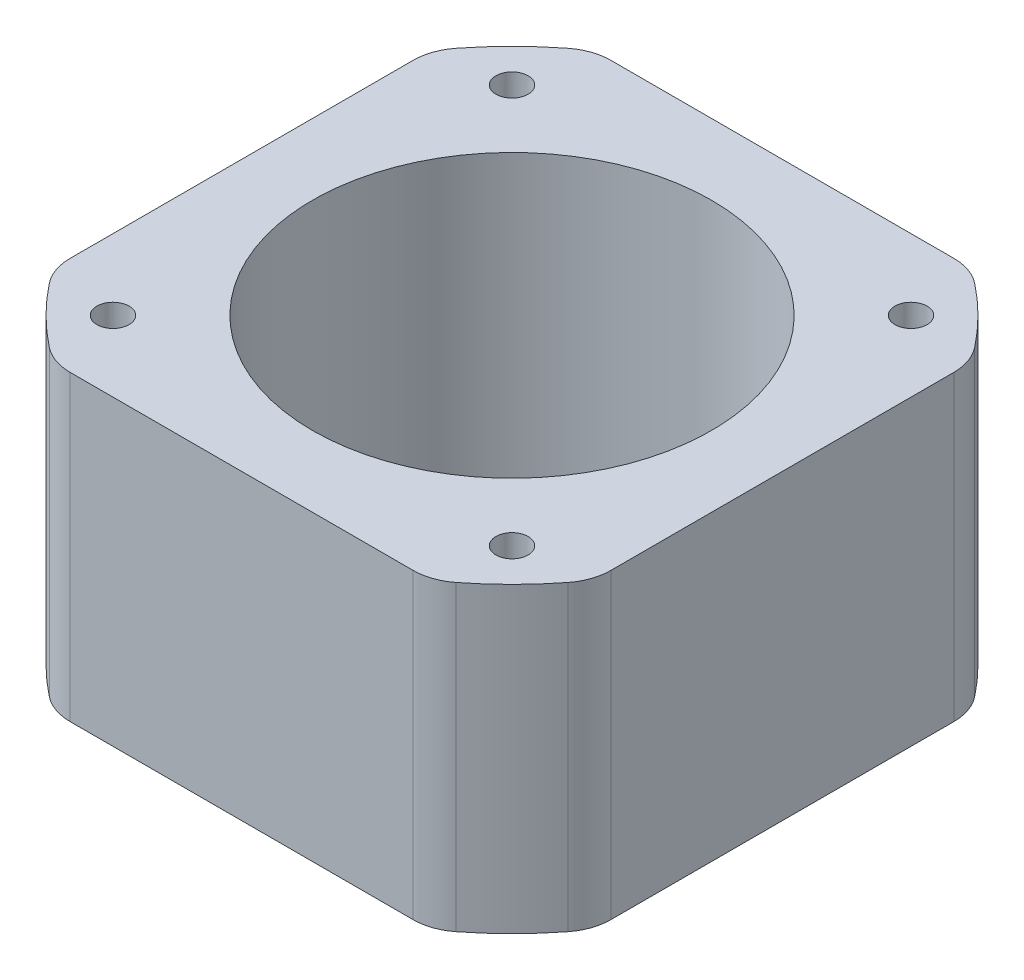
SolidWorks part; units mm, degrees
ref_plane "Спереди" through (0, 0, 0) normal (0, 0, 1) x (1, 0, 0)
ref_plane "Сверху" through (0, 0, 0) normal (0, 1, 0) x (1, 0, 0)
ref_plane "Справа" through (0, 0, 0) normal (1, 0, 0) x (0, 0, -1)
sketch "Эскиз1" plane through (0, 0, 0) normal (0, 1, 0) x (1, 0, 0)
  line L1 (-14.641, -21) -> (14.641, -21)
  line L2 (-21, -14.641) -> (-21, 14.641)
  line L3 (-14.641, 21) -> (14.641, 21)
  line L4 (21, -14.641) -> (21, 14.641)
  line L5 (-21, -21) -> (21, 21) construction
  line L6 (-21, 21) -> (21, -21) construction
  line L10 (-15.5, -15.5) -> (15.5, -15.5) construction
  line L11 (-15.5, -15.5) -> (-15.5, 15.5) construction
  line L12 (-15.5, 15.5) -> (15.5, 15.5) construction
  line L13 (15.5, -15.5) -> (15.5, 15.5) construction
  line L14 (-15.5, -15.5) -> (15.5, 15.5) construction
  line L15 (-15.5, 15.5) -> (15.5, -15.5) construction
  circle A0 centre (-15.5, 15.5) radius 1.25
  circle A1 centre (15.5, 15.5) radius 1.25
  circle A2 centre (15.5, -15.5) radius 1.25
  circle A3 centre (-15.5, -15.5) radius 1.25
  circle A4 centre (0, 0) radius 15.5
  arc A7 (-21, -14.641) -> (-14.641, -21) centre (0, 0) ccw
  arc A8 (-14.641, 21) -> (-21, 14.641) centre (0, 0) ccw
  arc A9 (21, 14.641) -> (14.641, 21) centre (0, 0) ccw
  arc A10 (14.641, -21) -> (21, -14.641) centre (0, 0) ccw
  point P0 (0, 0)
  point P13 (0, 0)
  dimension "D9" = 2.5
  dimension "D14" = 25.6
  dimension "D15" = 31
  dimension "D16" = 42
extrude "Бобышка-Вытянуть1" add sketch "Эскиз1" along normal blind 23.5
fillet "Скругление1" radius 4 8 edges at (-21, 11.75, -14.641) (-14.641, 11.75, -21) (14.641, 11.75, -21) (21, 11.75, -14.641) (21, 11.75, 14.641) (14.641, 11.75, 21) (-14.641, 11.75, 21) (-21, 11.75, 14.641)
